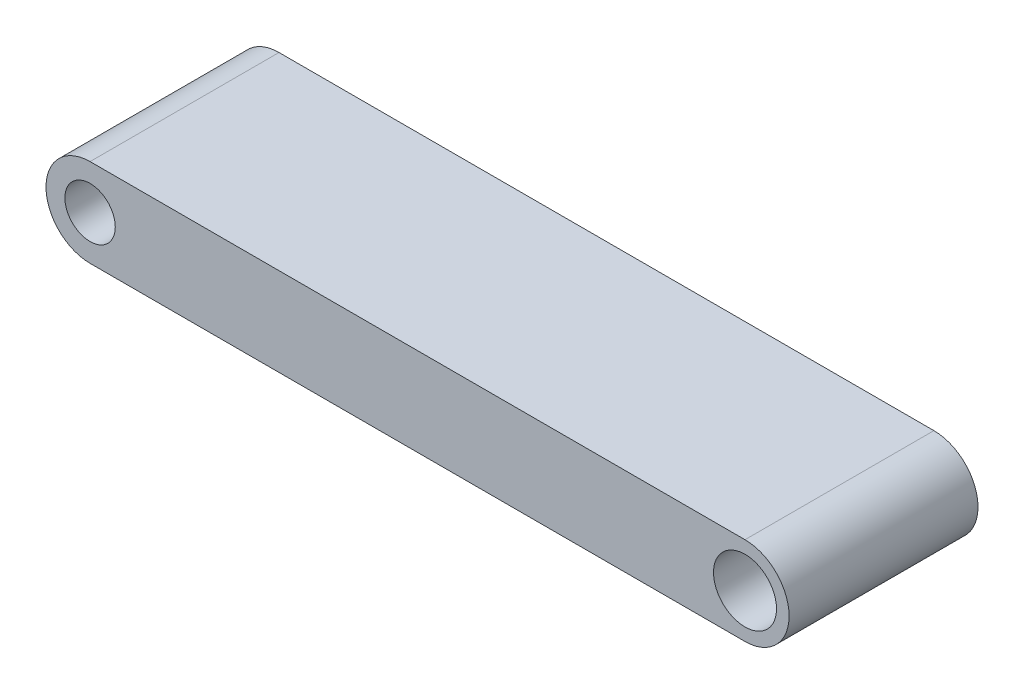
SolidWorks part; units mm, degrees
ref_plane "前视基准面" through (0, 0, 0) normal (0, 0, 1) x (1, 0, 0)
ref_plane "上视基准面" through (0, 0, 0) normal (0, 1, 0) x (1, 0, 0)
ref_plane "右视基准面" through (0, 0, 0) normal (1, 0, 0) x (0, 0, -1)
sketch "草图1" plane through (0, 0, 0) normal (0, 0, 1) x (1, 0, 0)
  line L0 (26, 0) -> (-26, 0) construction
  line L1 (26, -3.5) -> (-26, -3.5)
  line L2 (26, 3.5) -> (-26, 3.5)
  arc A0 (26, -3.5) -> (26, 3.5) centre (26, 0) ccw
  arc A1 (-26, 3.5) -> (-26, -3.5) centre (-26, 0) ccw
  point P2 (0, 0)
  dimension "D1" = 3.5
  dimension "D2" = 52
extrude "凸台-拉伸1" add sketch "草图1" along normal mid plane 15
sketch "草图2" plane through (0, 0, 7.5) normal (0, 0, 1) x (1, 0, 0)
  circle A0 centre (26, 0) radius 2.5
  dimension "D1" = 5
extrude "切除-拉伸1" cut sketch "草图2" against normal blind 15
sketch "草图3" plane through (0, 0, 7.5) normal (0, 0, 1) x (1, 0, 0)
  circle A0 centre (-26, 0) radius 2
  dimension "D1" = 4
extrude "切除-拉伸2" cut sketch "草图3" against normal through all
